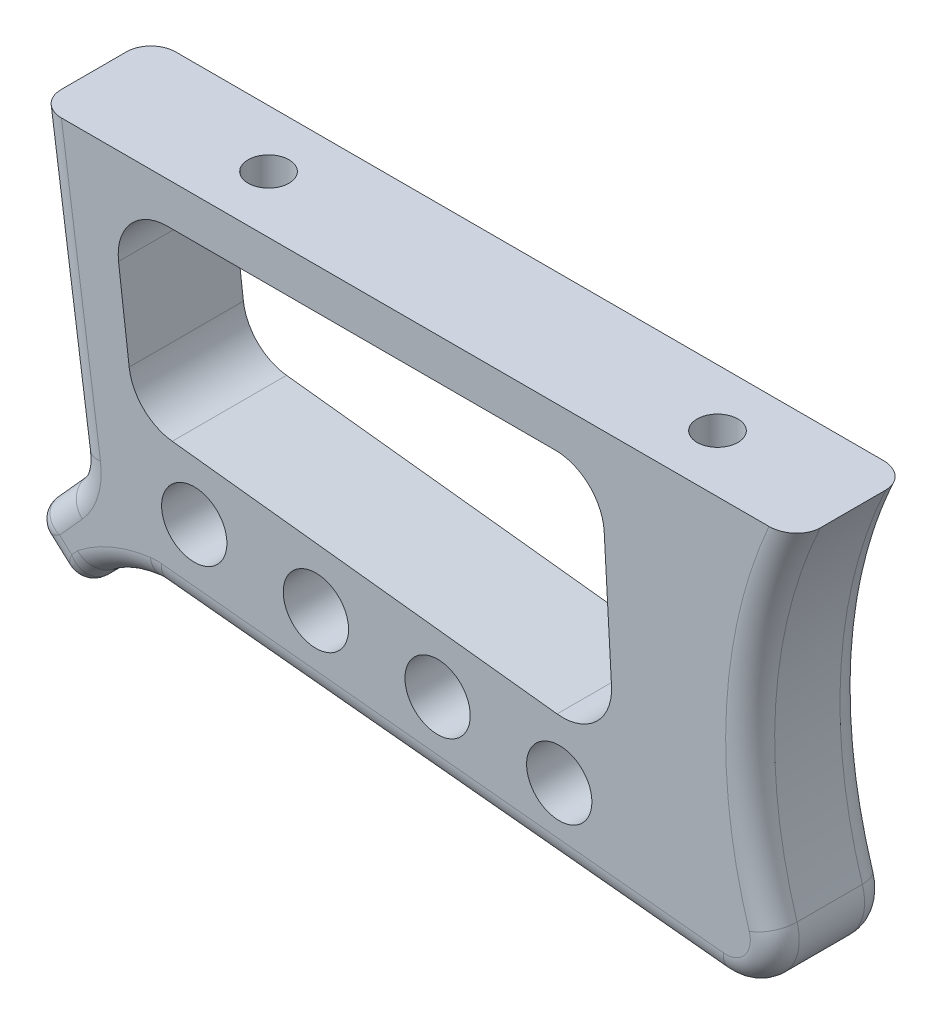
SolidWorks part; units mm, degrees
ref_plane "前视基准面" through (0, 0, 0) normal (0, 0, 1) x (1, 0, 0)
ref_plane "上视基准面" through (0, 0, 0) normal (0, 1, 0) x (1, 0, 0)
ref_plane "右视基准面" through (0, 0, 0) normal (1, 0, 0) x (0, 0, -1)
sketch "草图1" plane through (0, 0, 0) normal (0, 0, 1) x (1, 0, 0)
  line L0 (0, 0) -> (-93, 0)
  line L1 (-93, 0) -> (-88.1613, -34.4294)
  line L2 (-89.644, -39.2792) -> (-93.0966, -43.1137)
  line L3 (-92.9486, -45.9383) -> (-89.976, -48.6148)
  line L4 (-87.1515, -48.4668) -> (-85.9465, -47.1285)
  line L5 (-78.3419, -44.1143) -> (-9.1758, -51.018)
  line L6 (0, 0) -> (0, -132.0641) construction
  line L7 (-77.0182, -5) -> (-29.4713, -5)
  line L8 (-23.4808, -10.6623) -> (-22.5838, -26.5732)
  line L9 (-29.2507, -32.8727) -> (-76.3979, -27.5233)
  line L10 (-81.6767, -22.2927) -> (-82.9735, -11.7312)
  line L11 (-75.3262, -34.8155) -> (-24.6165, -40.5692) construction
  arc A0 (-2.8544, -43.2534) -> (0, 0) centre (54.4, -25.3109) cw
  arc A1 (-89.976, -48.6148) -> (-87.1515, -48.4668) centre (-88.6377, -47.1285) ccw
  arc A2 (-93.0966, -43.1137) -> (-92.9486, -45.9383) centre (-91.6103, -44.452) ccw
  arc A3 (-9.1758, -51.018) -> (-2.8544, -43.2534) centre (-8.5798, -45.0477) ccw
  arc A4 (-88.1613, -34.4294) -> (-89.644, -39.2792) centre (-94.1029, -35.2644) cw
  arc A5 (-85.9465, -47.1285) -> (-78.3419, -44.1143) centre (-76.8265, -59.0375) cw
  arc A6 (-22.5838, -26.5732) -> (-29.2507, -32.8727) centre (-28.5743, -26.911) cw
  arc A7 (-29.4713, -5) -> (-23.4808, -10.6623) centre (-29.4713, -11) cw
  arc A8 (-76.3979, -27.5233) -> (-81.6767, -22.2927) centre (-75.7214, -21.5615) cw
  arc A9 (-77.0182, -5) -> (-82.9735, -11.7312) centre (-77.0182, -11) ccw
  circle A10 centre (-73.7, -35) radius 4
  circle A11 centre (-58.7956, -36.6911) radius 4
  circle A12 centre (-43.8913, -38.3822) radius 4
  circle A13 centre (-28.9869, -40.0733) radius 4
  point P11 (-88.4897, -49.953)
  point P14 (-94.4349, -44.6)
  point P18 (0.6628, -52)
  point P21 (-87.7719, -37.2)
  point P32 (-23.8, -5)
  point P35 (-81.1, -26.9897)
  point P38 (-83.8, -5)
  point P49 (0, 0)
  dimension "D2" = 60
  dimension "D9" = 84.3
  dimension "D11" = 2
  dimension "D12" = 6
  dimension "D13" = 15
  dimension "D20" = 6
  dimension "D24" = 8
  dimension "D1" = 8
  dimension "D3" = 54.4
  dimension "D4" = 44.6
  dimension "D5" = 93
  dimension "D6" = 130
  dimension "D7" = 82
  dimension "D8" = 52
  dimension "D10" = 37.2
  dimension "D14" = 83
  dimension "D15" = 80.3
  dimension "D16" = 69.2
  dimension "D17" = 9.2
  dimension "D18" = 5
  dimension "D19" = 11.9
  dimension "D21" = 15
  dimension "D22" = 15
  dimension "D23" = 15
  dimension "D25" = 35
  dimension "D26" = 19.3
extrude "凸台-拉伸1" add sketch "草图1" along normal mid plane 14
fillet "圆角3" radius 3 9 edges at (-82.3536, -45.093, 7) (-82.3536, -45.093, -7) (-5.4698, -21.3599, 7) (-3.9269, -48.8358, 7) (-5.4698, -21.3599, -7) (-3.9269, -48.8358, -7) (-78.3419, -44.1143, 0) (-43.7588, -47.5661, 7) (-43.7588, -47.5661, -7)
fillet "圆角4" radius 3 7 edges at (-84.0148, -44.9831, -7) (-88.5331, -49.1258, -7) (-91.4623, -47.2765, -7) (-93.6076, -44.5566, -7) (-91.3703, -41.1965, -7) (-88.365, -37.0187, -7) (-90.5806, -17.2147, -7)
fillet "圆角6" radius 3 7 edges at (-84.0148, -44.9831, 7) (-88.5331, -49.1258, 7) (-91.4623, -47.2765, 7) (-93.6076, -44.5566, 7) (-91.3703, -41.1965, 7) (-88.365, -37.0187, 7) (-90.5806, -17.2147, 7)
hole_wizard "M6 螺纹孔1" positions "草图2" profile "草图4" tap size "M6" standard "GB"
sketch "草图2" plane through (0, 0, 0) normal (0, 1, 0) x (1, 0, 0)
  line L0 (-93, -4) -> (-93, 4) construction
  point P0 (-16.6, 0)
  point P2 (-71.6, 0)
  point P5 (0, 0)
  dimension "D1" = 55
  dimension "D2" = 21.4
sketch "草图4" plane through (-16.6, 0, 0) normal (1, 0, 0) x (0, 0, 1)
  line L0 (0, 0) -> (0, 14.5022)
  line L1 (0, 14.5022) -> (2.5, 13)
  line L2 (2.5, 13) -> (2.5, 0)
  line L5 (2.5, 0) -> (0, 0)
  line L10 (0, 14.5022) -> (-2.5, 13) construction
  line L11 (0, -6.35) -> (0, 107.95) construction
  dimension "螺纹孔钻头直径" = 5
  dimension "螺纹孔钻头深度" = 13
  dimension "导头角度" = 118
sketch "草图5" plane through (0, 0, 0) normal (0, 0, 1) x (1, 0, 0)
  line L0 (-18.6, -60.3948) -> (-18.6, 0.2107) construction
  line L2 (-18.6, -47.5) -> (-24.6, -47.5)
  line L3 (-18.6, -47.5) -> (-18.6, -64.218)
  line L4 (-18.6, -64.218) -> (-24.6, -64.218)
  line L5 (-24.6, -47.5) -> (-24.6, -64.218)
  dimension "D1" = 6
  dimension "D2" = 47.5
  dimension "D3" = 18.6
revolve "切除-旋转1" cut sketch "草图5" angle 360 about L0
hole_wizard "M8 螺纹孔1" positions "草图6" profile "草图7" tap size "M8" standard "GB"
sketch "草图6" plane through (0, -47.5, 0) normal (0, -1, 0) x (-1, 0, 0)
  point P0 (18.6, 0)
sketch "草图7" plane through (-18.6, -47.5, 0) normal (1, 0, 0) x (0, 0, -1)
  line L0 (0, 0) -> (0, 17.7929)
  line L1 (0, 17.7929) -> (3.4, 15.75)
  line L2 (3.4, 15.75) -> (3.4, 0)
  line L5 (3.4, 0) -> (0, 0)
  line L10 (0, 17.7929) -> (-3.4, 15.75) construction
  line L11 (0, -6.35) -> (0, 107.95) construction
  dimension "螺纹孔钻头直径" = 6.8
  dimension "螺纹孔钻头深度" = 15.75
  dimension "导头角度" = 118
